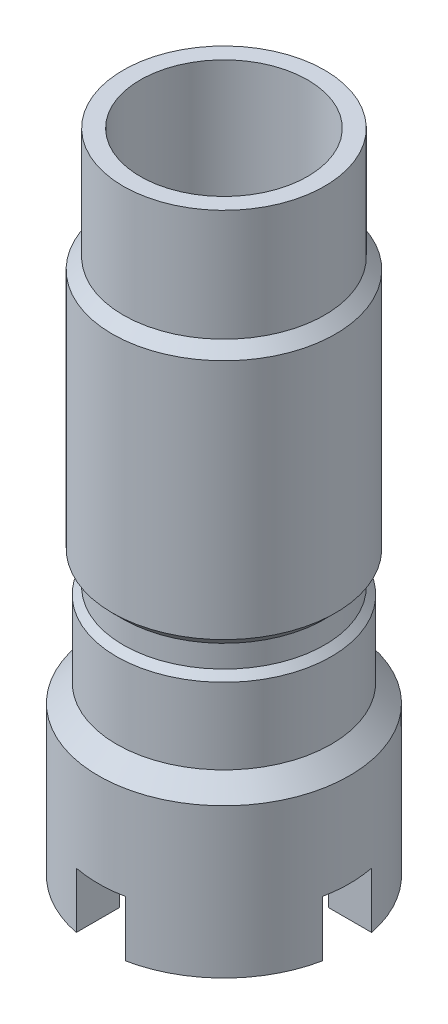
SolidWorks part; units mm, degrees
ref_plane "Front Plane" through (0, 0, 0) normal (0, 0, 1) x (1, 0, 0)
ref_plane "Top Plane" through (0, 0, 0) normal (0, 1, 0) x (1, 0, 0)
ref_plane "Right Plane" through (0, 0, 0) normal (1, 0, 0) x (0, 0, -1)
sketch "Sketch1" plane through (0, 0, 0) normal (0, 0, 1) x (1, 0, 0)
  line L0 (0, 0) -> (0, 31.3505) construction
  line L1 (-4.7625, 0) -> (-4.7625, 36.83)
  line L2 (-4.7625, 0) -> (-7.1438, 0)
  line L3 (-7.1438, 0) -> (-7.1437, 8.49)
  line L4 (-7.1437, 8.49) -> (-6.1087, 9.525)
  line L5 (-6.1087, 9.525) -> (-6.1087, 13.843)
  line L6 (-5.7277, 15.494) -> (-6.35, 16.1163)
  line L7 (-5.7277, 36.83) -> (-5.7277, 30.48)
  line L8 (-5.7277, 30.48) -> (-6.35, 29.8577)
  line L9 (-6.35, 16.1163) -> (-6.35, 29.8577)
  line L10 (-5.7277, 36.83) -> (-4.7625, 36.83)
  line L11 (-5.7277, 15.494) -> (-5.7277, 14.224)
  line L12 (-5.7277, 14.224) -> (-6.1087, 13.843)
  dimension "D1" = 14.2875
  dimension "D2" = 9.525
  dimension "D3" = 12.2174
  dimension "D4" = 45
  dimension "D5" = 9.525
  dimension "D6" = 1.27
  dimension "D7" = 12.7
  dimension "D8" = 36.83
  dimension "D9" = 11.4554
  dimension "D10" = 6.35
  dimension "D11" = 14.224
revolve "Revolve1" add sketch "Sketch1" angle 360 about L0
sketch "Sketch2" plane through (0, 0, 0) normal (0, -1, 0) x (1, 0, 0)
  line L0 (1.397, 1.397) -> (7.1438, 1.397)
  line L1 (-1.397, -7.1438) -> (1.397, -7.1438)
  line L2 (-1.397, -7.1438) -> (-1.397, -1.397)
  line L3 (-1.397, 7.1438) -> (1.397, 7.1438)
  line L4 (1.397, -7.1438) -> (1.397, -1.397)
  line L5 (-7.1437, 1.397) -> (-1.397, 1.397)
  line L6 (-7.1437, 1.397) -> (-7.1437, -1.397)
  line L7 (-7.1437, -1.397) -> (-1.397, -1.397)
  line L8 (7.1438, 1.397) -> (7.1438, -1.397)
  line L9 (-1.397, 1.397) -> (-1.397, 7.1438)
  line L10 (1.397, -1.397) -> (7.1438, -1.397)
  line L11 (1.397, 1.397) -> (1.397, 7.1438)
  line L12 (-1.397, -1.397) -> (1.397, 1.397) construction
  circle A0 centre (0, 0) radius 7.1438 construction
  dimension "D1" = 2.794
extrude "Extrude1" cut sketch "Sketch2" against normal blind 3.175
